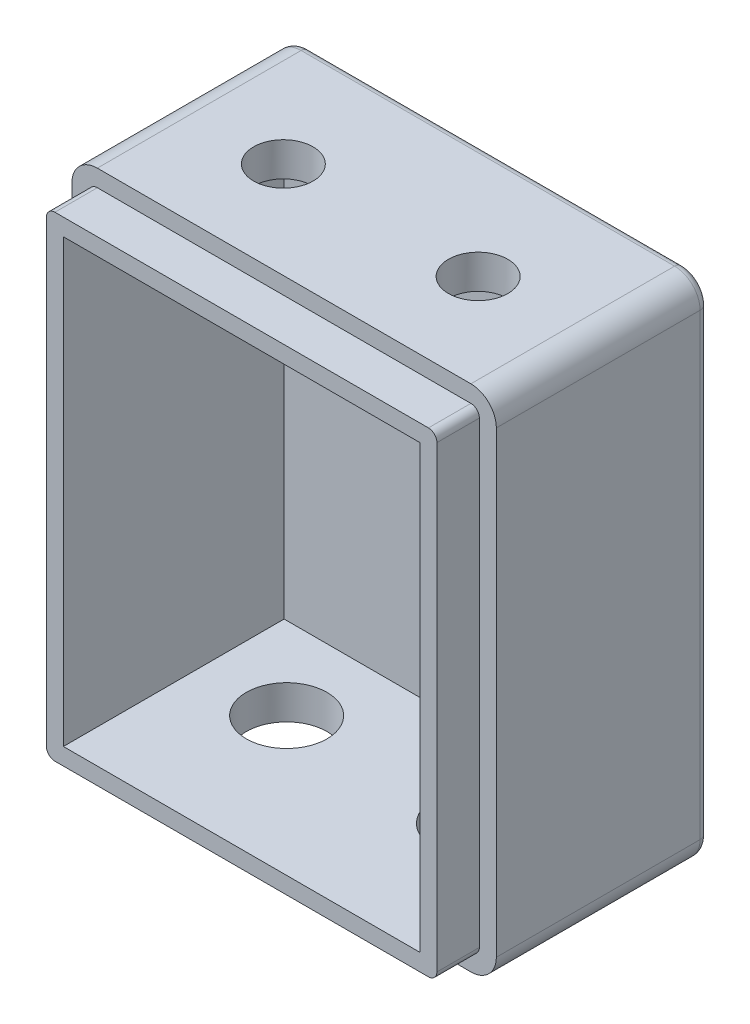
SolidWorks part; units mm, degrees
ref_plane "Front" through (0, 0, 0) normal (0, 0, 1) x (1, 0, 0)
ref_plane "Top" through (0, 0, 0) normal (0, 1, 0) x (1, 0, 0)
ref_plane "Right" through (0, 0, 0) normal (1, 0, 0) x (0, 0, -1)
sketch "Sketch1" plane through (0, 0, 0) normal (0, 0, 1) x (1, 0, 0)
  line L1 (0, 0) -> (50, 0)
  line L2 (0, 0) -> (0, 60)
  line L3 (0, 60) -> (50, 60)
  line L4 (50, 0) -> (50, 60)
  dimension "D1" = 50
  dimension "D2" = 60
extrude "Boss-Extrude1" add sketch "Sketch1" along normal blind 30
fillet "Fillet1" radius 3 4 edges at (50, 0, 15) (0, 0, 15) (0, 60, 15) (50, 60, 15)
shell "Shell1" thickness 4
fillet "Fillet4" radius 1 8 edges at (49.1213, 59.1213, 0) (25, 60, 0) (0.8787, 59.1213, 0) (0, 30, 0) (0.8787, 0.8787, 0) (25, 0, 0) (49.1213, 0.8787, 0) (50, 30, 0)
sketch "Sketch3" plane through (0, 0, 30) normal (0, 0, 1) x (1, 0, 0)
  line L4 (3, 0) -> (47, 0)
  line L5 (50, 3) -> (50, 57)
  line L6 (47, 60) -> (3, 60)
  line L7 (0, 57) -> (0, 3)
  line L8 (3, 0) -> (47, 0)
  line L9 (50, 3) -> (50, 57)
  line L10 (47, 60) -> (3, 60)
  line L11 (0, 57) -> (0, 3)
  line L20 (3, 2) -> (47, 2)
  line L21 (48, 3) -> (48, 57)
  line L22 (47, 58) -> (3, 58)
  line L23 (2, 57) -> (2, 3)
  line L24 (3, 2) -> (47, 2)
  line L25 (48, 3) -> (48, 57)
  line L26 (47, 58) -> (3, 58)
  line L27 (2, 57) -> (2, 3)
  arc A4 (47, 0) -> (50, 3) centre (47, 3) ccw
  arc A5 (50, 57) -> (47, 60) centre (47, 57) ccw
  arc A6 (3, 60) -> (0, 57) centre (3, 57) ccw
  arc A7 (0, 3) -> (3, 0) centre (3, 3) ccw
  arc A8 (47, 0) -> (50, 3) centre (47, 3) ccw
  arc A9 (50, 57) -> (47, 60) centre (47, 57) ccw
  arc A10 (3, 60) -> (0, 57) centre (3, 57) ccw
  arc A11 (0, 3) -> (3, 0) centre (3, 3) ccw
  arc A20 (47, 2) -> (48, 3) centre (47, 3) ccw
  arc A21 (48, 57) -> (47, 58) centre (47, 57) ccw
  arc A22 (3, 58) -> (2, 57) centre (3, 57) ccw
  arc A23 (2, 3) -> (3, 2) centre (3, 3) ccw
  arc A24 (47, 2) -> (48, 3) centre (47, 3) ccw
  arc A25 (48, 57) -> (47, 58) centre (47, 57) ccw
  arc A26 (3, 58) -> (2, 57) centre (3, 57) ccw
  arc A27 (2, 3) -> (3, 2) centre (3, 3) ccw
  dimension "D1" = 0
  dimension "D2" = 2
extrude "Cut-Extrude1" cut sketch "Sketch3" against normal blind 5
sketch "Sketch4" plane through (0, 0, 0) normal (0, -1, 0) x (1, 0, 0)
  line L0 (25, 25) -> (25, -6.6415) construction
  line L1 (3, 25) -> (47, 25) construction
  line L2 (14, 13.7002) -> (36, 13.7002) construction
  circle A0 centre (36, 13.7002) radius 4.75
  circle A1 centre (14, 13.7002) radius 4.75
  point P6 (25, 13.7002)
  dimension "D2" = 9.5
  dimension "D3" = 9.5
  dimension "D1" = 11
extrude "Cut-Extrude2" cut sketch "Sketch4" against normal up to next
sketch "Sketch5" plane through (0, 60, 0) normal (0, 1, 0) x (1, 0, 0)
  line L0 (25, -25) -> (25, 49975) construction
  line L1 (47, -25) -> (3, -25) construction
  line L2 (13.5269, -13.6186) -> (36.4731, -13.6186) construction
  circle A0 centre (13.5269, -13.6186) radius 3.5
  circle A1 centre (36.4731, -13.6186) radius 3.5
  point P4 (25, -25)
  point P7 (25, -13.6186)
  dimension "D1" = 7
  dimension "D2" = 7
extrude "Cut-Extrude3" cut sketch "Sketch5" against normal up to next
